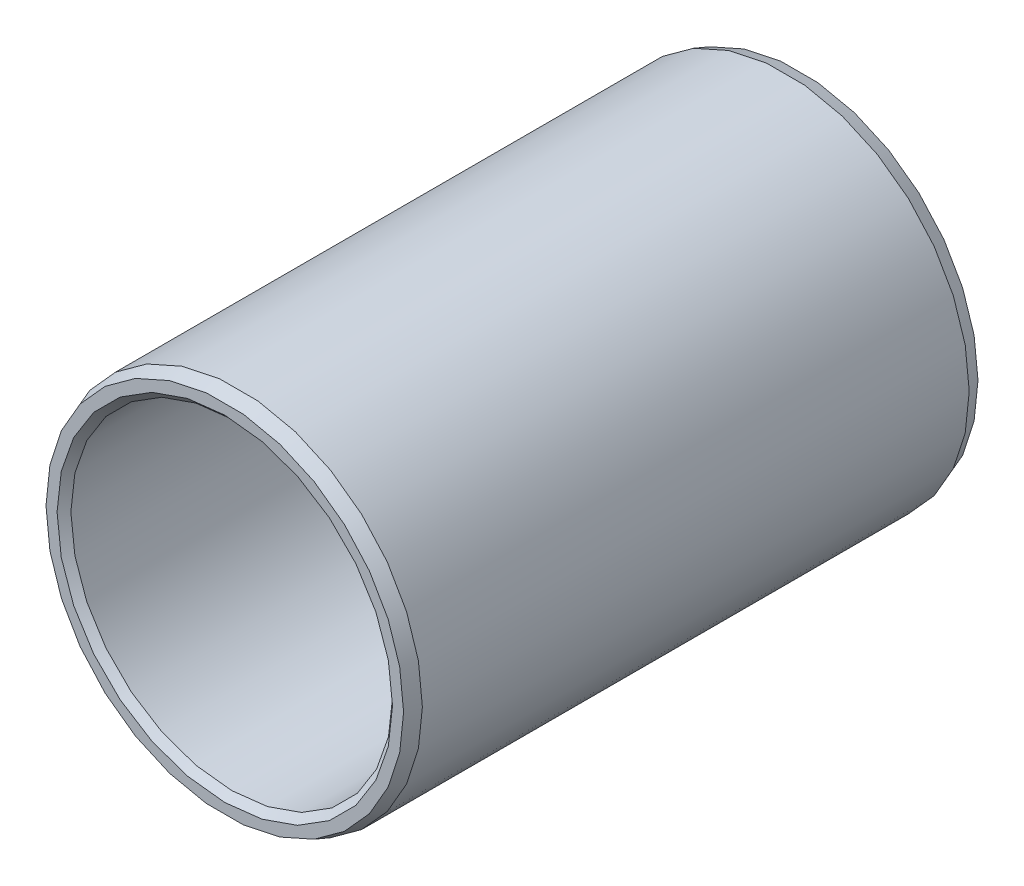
SolidWorks part; units mm, degrees
ref_plane "Face" through (0, 0, 0) normal (0, 0, 1) x (1, 0, 0)
ref_plane "Dessus" through (0, 0, 0) normal (0, 1, 0) x (1, 0, 0)
ref_plane "Côté" through (0, 0, 0) normal (1, 0, 0) x (0, 0, -1)
sketch "Esquisse1" plane through (0, 0, 0) normal (0, 0, 1) x (1, 0, 0)
  circle A0 centre (0, 0) radius 3.5
  circle A1 centre (0, 0) radius 4.5
  dimension "Ø1" = 7
  dimension "Ø2" = 9
extrude "Base-Extrusion" add sketch "Esquisse1" along normal blind 10
chamfer "Chanfrein1" distance 0.6 angle 20 2 edges at (4.5, 0, 0) (4.5, 0, 10)
chamfer "Chanfrein2" distance 0.3 angle 45 2 edges at (3.5, 0, 0) (3.5, 0, 10)
